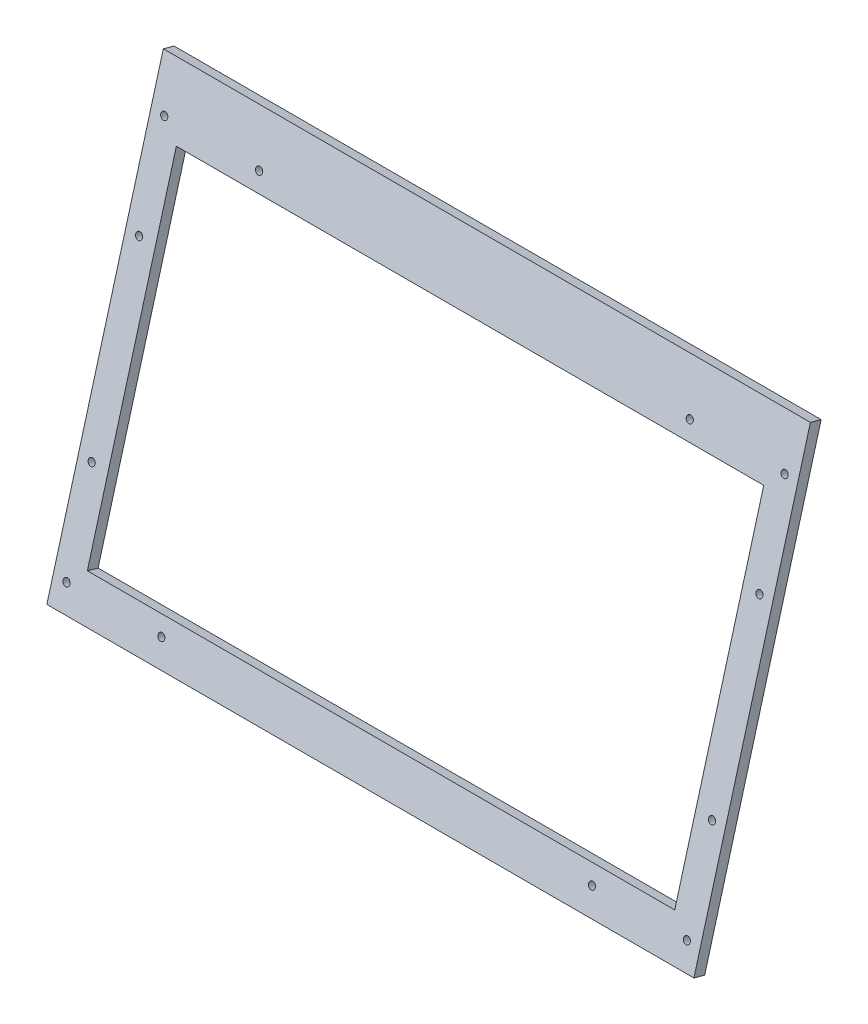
SolidWorks part; units mm, degrees
ref_plane "Plan de face" through (0, 0, 0) normal (0, 0, 1) x (1, 0, 0)
ref_plane "Plan de dessus" through (0, 0, 0) normal (0, 1, 0) x (1, 0, 0)
ref_plane "Plan de droite" through (0, 0, 0) normal (1, 0, 0) x (0, 0, -1)
sketch "Esquisse2" plane through (0, 0, 0) normal (1, 0, 0) x (0, 0, -1)
  line L11 (12.1264, -6.0768) -> (-92.2724, -385.1744)
  line L20 (-92.2724, -385.1744) -> (-101.9135, -382.5194)
  line L21 (-101.9135, -382.5194) -> (2.4853, -3.4218)
  line L22 (2.4853, -3.4218) -> (12.1264, -6.0768)
  dimension "D1" = 10
  dimension "D2" = 393.21
extrude "Boss.-Extru.3" add sketch "Esquisse2" along normal blind 600
sketch "Esquisse6" plane through (0, -0.8774, -3.186) normal (0, 0.2655, 0.9641) x (1, 0, 0)
  line L0 (600, -2.6391) -> (600, -395.8491) construction
  line L1 (36.75, -59.3891) -> (563.25, -59.3891)
  line L2 (36.75, -59.3891) -> (36.75, -359.8891)
  line L3 (36.75, -359.8891) -> (563.25, -359.8891)
  line L4 (563.25, -59.3891) -> (563.25, -359.8891)
  line L5 (600, -2.6391) -> (0, -2.6391) construction
  line L6 (600, -395.8491) -> (0, -395.8491) construction
  dimension "D1" = 300.5
  dimension "D2" = 526.5
  dimension "D3" = 36.75
  dimension "D4" = 56.75
  dimension "D5" = 35.96
extrude "Enlèv. mat.-Extru.1" cut sketch "Esquisse6" against normal blind 500
sketch "Esquisse7" plane through (0, -0.8774, -3.186) normal (0, 0.2655, 0.9641) x (1, 0, 0)
  line L1 (0, -2.6391) -> (10, -2.6391)
  line L2 (0, -2.6391) -> (0, -395.8491)
  line L3 (0, -395.8491) -> (10, -395.8491)
  line L4 (10, -2.6391) -> (10, -395.8491)
  line L6 (600, -2.6391) -> (590, -2.6391)
  line L7 (600, -2.6391) -> (600, -395.8491)
  line L8 (600, -395.8491) -> (590, -395.8491)
  line L9 (590, -2.6391) -> (590, -395.8491)
  dimension "D1" = 393.21
  dimension "D2" = 10
  dimension "D3" = 393.21
  dimension "D4" = 10
extrude "Enlèv. mat.-Extru.2" cut sketch "Esquisse7" against normal blind 10
sketch "Esquisse8" plane through (0, -3.5324, -12.8271) normal (0, -0.2655, -0.9641) x (-1, 0, 0)
  line L0 (-590, -2.6391) -> (-590, -395.8491) construction
  line L1 (-563.25, -359.8891) -> (-563.25, -59.3891) construction
  line L2 (-36.75, -359.8891) -> (-563.25, -359.8891) construction
  line L3 (-36.75, -59.3891) -> (-36.75, -359.8891) construction
  line L4 (-590, -2.6391) -> (-10, -2.6391) construction
  line L6 (-563.25, -59.3891) -> (-36.75, -59.3891) construction
  line L7 (-10, -395.8491) -> (-10, -2.6391) construction
  circle A1 centre (-578, -129.6391) radius 3.1
  circle A2 centre (-493, -44.6391) radius 3.1
  circle A3 centre (-578, -289.6391) radius 3.1
  circle A5 centre (-493, -374.6391) radius 3.1
  circle A6 centre (-107, -374.6391) radius 3.1
  circle A7 centre (-22, -289.6391) radius 3.1
  circle A9 centre (-22, -129.6391) radius 3.1
  circle A10 centre (-107, -44.6391) radius 3.1
  circle A12 centre (-578, -44.6391) radius 3.1
  circle A13 centre (-578, -374.6391) radius 3.1
  circle A14 centre (-22, -374.6391) radius 3.1
  circle A15 centre (-22, -44.6391) radius 3.1
  dimension "D17" = 85
  dimension "D23" = 85
  dimension "D29" = 6.2
  dimension "D31" = 6.2
  dimension "D9" = 14.75
  dimension "D7" = 14.75
  dimension "D11" = 14.75
  dimension "D12" = 127
  dimension "D2" = 14.75
  dimension "D13" = 14.75
  dimension "D10" = 14.75
  dimension "D16" = 12
  dimension "D19" = 12
  dimension "D21" = 12
  dimension "D22" = 12
  dimension "D24" = 12
  dimension "D25" = 12
  dimension "D26" = 12
  dimension "D27" = 6.2
  dimension "D28" = 6.2
  dimension "D30" = 6.2
  dimension "D32" = 6.2
  dimension "D33" = 6.2
  dimension "D34" = 6.2
  dimension "D35" = 6.2
  dimension "D36" = 6.2
  dimension "D37" = 6.2
  dimension "D38" = 6.2
  dimension "D40" = 85
  dimension "D41" = 85
  dimension "D1" = 14.75
  dimension "D3" = 14.75
  dimension "D4" = 14.75
  dimension "D5" = 14.75
  dimension "D6" = 14.75
  dimension "D8" = 127
  dimension "D14" = 14.75
  dimension "D15" = 12
  dimension "D18" = 85
  dimension "D20" = 85
  dimension "D39" = 85
extrude "Enlèv. mat.-Extru.3" cut sketch "Esquisse8" against normal blind 10
